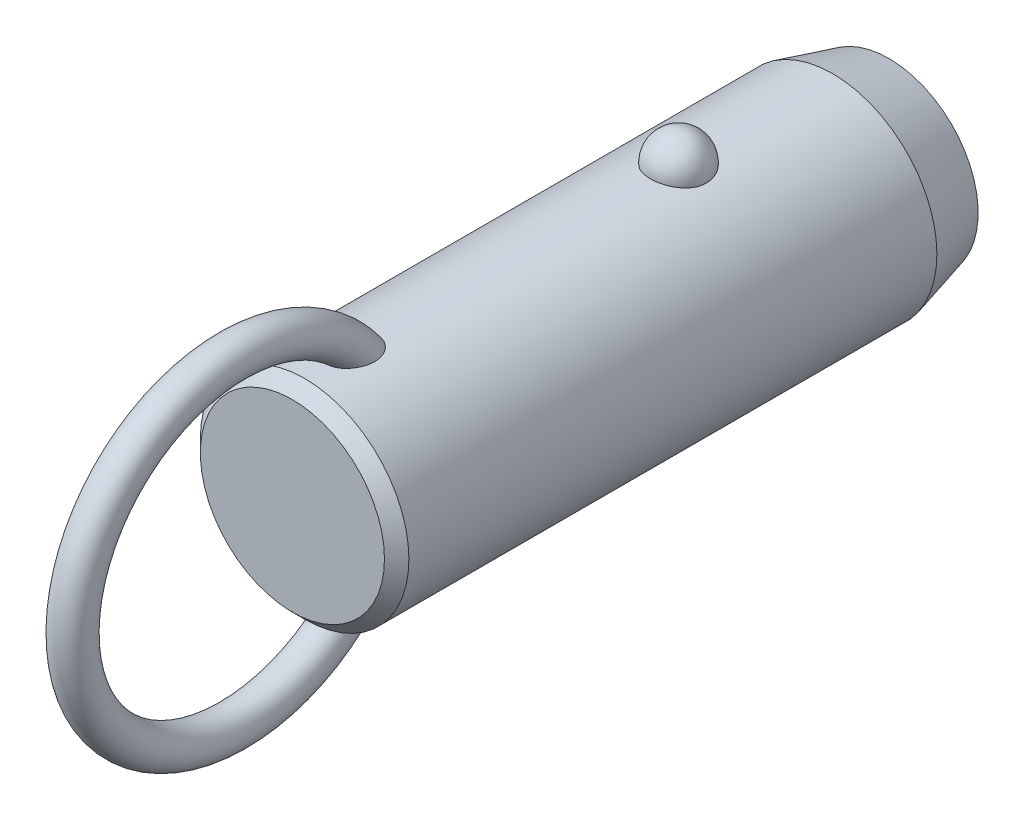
SolidWorks part; units mm, degrees
ref_plane "Front Plane" through (0, 0, 0) normal (0, 0, 1) x (1, 0, 0)
ref_plane "Top Plane" through (0, 0, 0) normal (0, 1, 0) x (1, 0, 0)
ref_plane "Right Plane" through (0, 0, 0) normal (1, 0, 0) x (0, 0, -1)
sketch "Sketch2" plane through (0, 0, 0) normal (0, 0, 1) x (1, 0, 0)
  circle A0 centre (0, 0) radius 11.1
  point P3 (0, 11.1)
  dimension "D1" = 22.2
extrude "Boss-Extrude1" add sketch "Sketch2" along normal blind 25.4
sketch "Sketch3" plane through (0, 0, 0) normal (0, 0, -1) x (-1, 0, 0)
  circle A0 centre (0, 0) radius 11.1
  dimension "D1" = 22.2
extrude "Boss-Extrude2" add sketch "Sketch3" along normal blind 25.4
chamfer "Chamfer1" distance 6 angle 15 1 edges at (-11.1, 0, -25.4)
sketch "Sketch12" plane through (0, 0, 0) normal (1, 0, 0) x (0, 0, -1)
  line L0 (-25.4, 11.1) -> (-25.4, -11.1) construction
  point P0 (-25.4, 0)
sketch "Sketch13" plane through (0, 0, 0) normal (1, 0, 0) x (0, 0, -1)
  circle A0 centre (-44.45, 0) radius 19.05
  point P2 (-25.4, 0)
  dimension "D1" = 38.1
sketch "Sketch14" plane through (0, 0, 0) normal (0, 1, 0) x (1, 0, 0)
  circle A0 centre (0, -27.4) radius 2
  point P2 (0, -25.4)
  dimension "D1" = 4
sweep "Sweep1" add profiles "Sketch14" path "Sketch13"
sketch "Sketch15" plane through (0, 0, 25.4) normal (0, 0, 1) x (1, 0, 0)
  circle A0 centre (0, 0) radius 11.1
  dimension "D1" = 22.2
extrude "Boss-Extrude3" add sketch "Sketch15" along normal blind 12.7
chamfer "Chamfer2" distance 1.3 angle 45 1 edges at (11.1, 0, 38.1)
sketch "Sketch18" plane through (0, 0, 0) normal (1, 0, 0) x (0, 0, -1)
  line L0 (19.4, 11.1) -> (-28.968, 11.1) construction
  line L1 (3, 14.1) -> (3, 8.1)
  line L2 (-28.968, -11.1) -> (19.4, -11.1) construction
  arc A0 (3, 14.1) -> (3, 8.1) centre (3, 11.1) ccw
  point P4 (0, 11.1)
  dimension "D1" = 25.2
revolve "Revolve1" add sketch "Sketch18" angle 360 about L1
